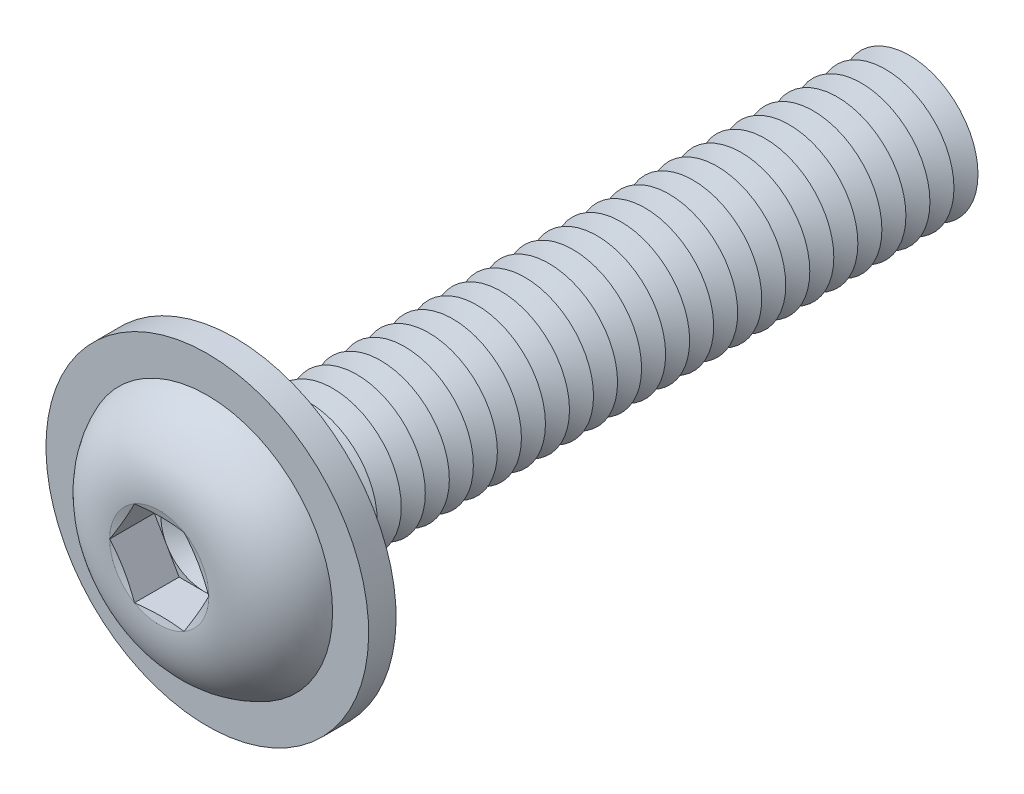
SolidWorks part; units mm, degrees
ref_plane "Front Plane" through (0, 0, 0) normal (0, 0, 1) x (1, 0, 0)
ref_plane "Top Plane" through (0, 0, 0) normal (0, 1, 0) x (1, 0, 0)
ref_plane "Right Plane" through (0, 0, 0) normal (1, 0, 0) x (0, 0, -1)
sketch "Sketch1" plane through (0, 0, 0) normal (1, 0, 0) x (0, 0, -1)
  line L0 (0, 2) -> (0, 3.8)
  line L3 (0, 2) -> (20, 2)
  line L4 (20, 2) -> (20, 0)
  line L5 (20, 0) -> (-2.2, 0) construction
  line L6 (-2.2, 0) -> (20, 0)
  line L7 (-2.2, 1.4434) -> (-2.2, 0.7217) construction
  line L8 (-2.2, 0.7217) -> (-2.2, 0)
  line L9 (-2.2, 1.4434) -> (-2.0066, 0.7217)
  line L10 (-2.0066, 0.7217) -> (-2.2, 0.7217)
  line L11 (20, 0) -> (22.7481, 0) construction
  line L12 (0, 3.8) -> (-2.2, 3.8) construction
  arc A1 (0, 3.8) -> (-2.2, 1.4434) centre (0, 1.5948) ccw
  point P8 (20, 1)
  dimension "D1" = 7.6
  dimension "D2" = 4
  dimension "D3" = 2.2
  dimension "D4" = 2.8868
  dimension "D5" = 20
  dimension "D6" = 15
revolve "Revolve1" add sketch "Sketch1" angle 360 about L5
fillet "Fillet1" radius 0.35 1 edges at (-2, 0, 0)
sketch "Sketch2" plane through (0, 0, 0) normal (1, 0, 0) x (0, 0, -1)
  line L0 (19.65, 2) -> (20.35, 2)
  line L1 (20, 2) -> (0.35, 2) construction
  line L2 (20.35, 2) -> (20, 1.3938)
  line L3 (20, -2) -> (20, 2) construction
  line L4 (20, 1.3938) -> (19.65, 2)
  dimension "D1" = 0.7
revolve "Cut-Revolve1" cut sketch "Sketch2" angle 360 about axis through (0, 0, -20) along (0, 0, -1)
pattern_linear "LPattern1" count 28 spacing 0.7 along (0, 0, 1) of "Cut-Revolve1"
sketch "Sketch3" plane through (0, 0, 2.2) normal (0, 0, 1) x (1, 0, 0)
  line L7 (0.7217, 1.25) -> (-0.7217, 1.25)
  line L8 (-0.7217, 1.25) -> (-1.4434, 0)
  line L9 (-1.4434, 0) -> (-0.7217, -1.25)
  line L10 (-0.7217, -1.25) -> (0.7217, -1.25)
  line L11 (0.7217, -1.25) -> (1.4434, 0)
  line L12 (1.4434, 0) -> (0.7217, 1.25)
  circle A0 centre (0, 0) radius 1.25 construction
  circle A3 centre (0, 0) radius 1.4434 construction
extrude "Cut-Extrude1" cut sketch "Sketch3" against normal blind 1.3
sketch "Sketch4" plane through (0, 0, 0.9) normal (0, 0, 1) x (1, 0, 0)
  line L1 (0.7217, 1.25) -> (-0.7217, 1.25) construction
  circle A0 centre (0, 0) radius 1.25
extrude "Cut-Extrude2" cut sketch "Sketch4" against normal through all draft 60
sketch "Sketch5" plane through (0, 0, 0) normal (0, 0, -1) x (-1, 0, 0)
  circle A0 centre (0, 0) radius 4.7
  circle A1 centre (0, 0) radius 2.35
  circle A2 centre (0, 0) radius 2.35 construction
  dimension "D1" = 9.4
extrude "Boss-Extrude1" add sketch "Sketch5" against normal blind 0.8
